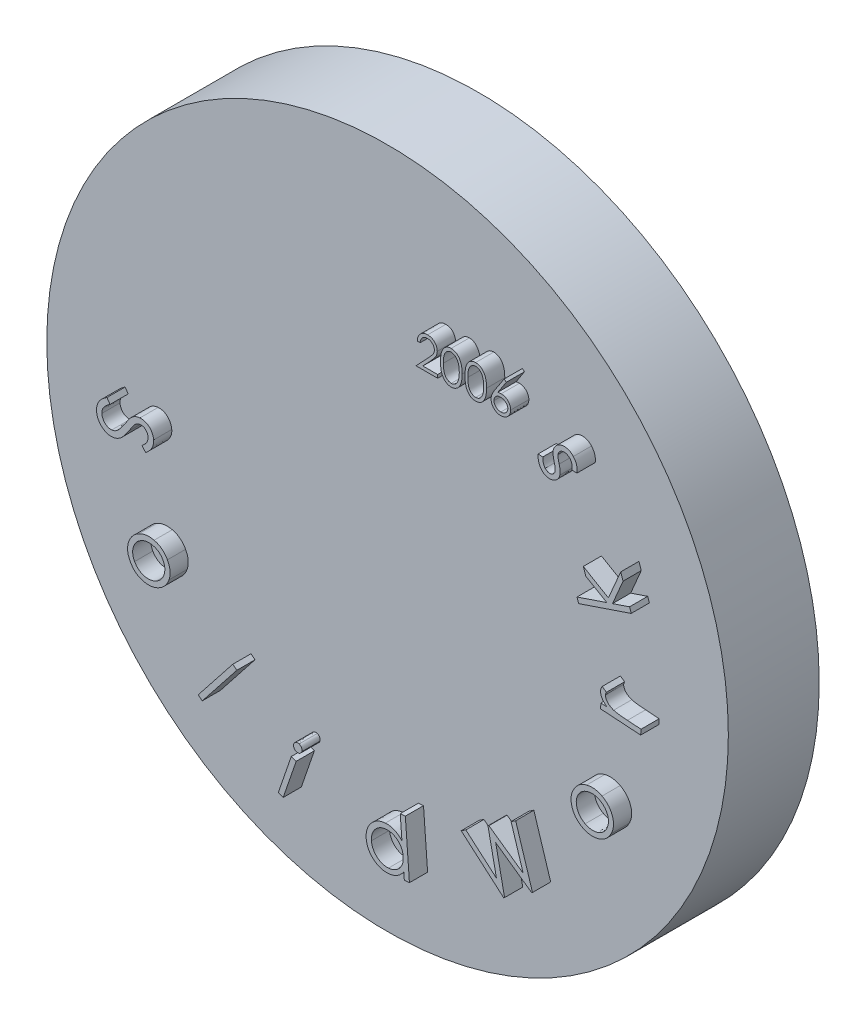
SolidWorks part; units mm, degrees
ref_plane "Front Plane" through (0, 0, 0) normal (0, 0, 1) x (1, 0, 0)
ref_plane "Top Plane" through (0, 0, 0) normal (0, 1, 0) x (1, 0, 0)
ref_plane "Right Plane" through (0, 0, 0) normal (1, 0, 0) x (0, 0, -1)
sketch "Sketch1" plane through (0, 0, 0) normal (0, 0, 1) x (1, 0, 0)
  circle A0 centre (0, 0) radius 37.5
  dimension "D1" = 75
extrude "Extrude1" add sketch "Sketch1" along normal blind 10
sketch "Sketch2"
  dimension "D1" = 30
  dimension "D2" = 135
  dimension "D3" = 20
  dimension "D4" = 5
extrude "Extrude2" add sketch "Sketch2" along normal blind 2
